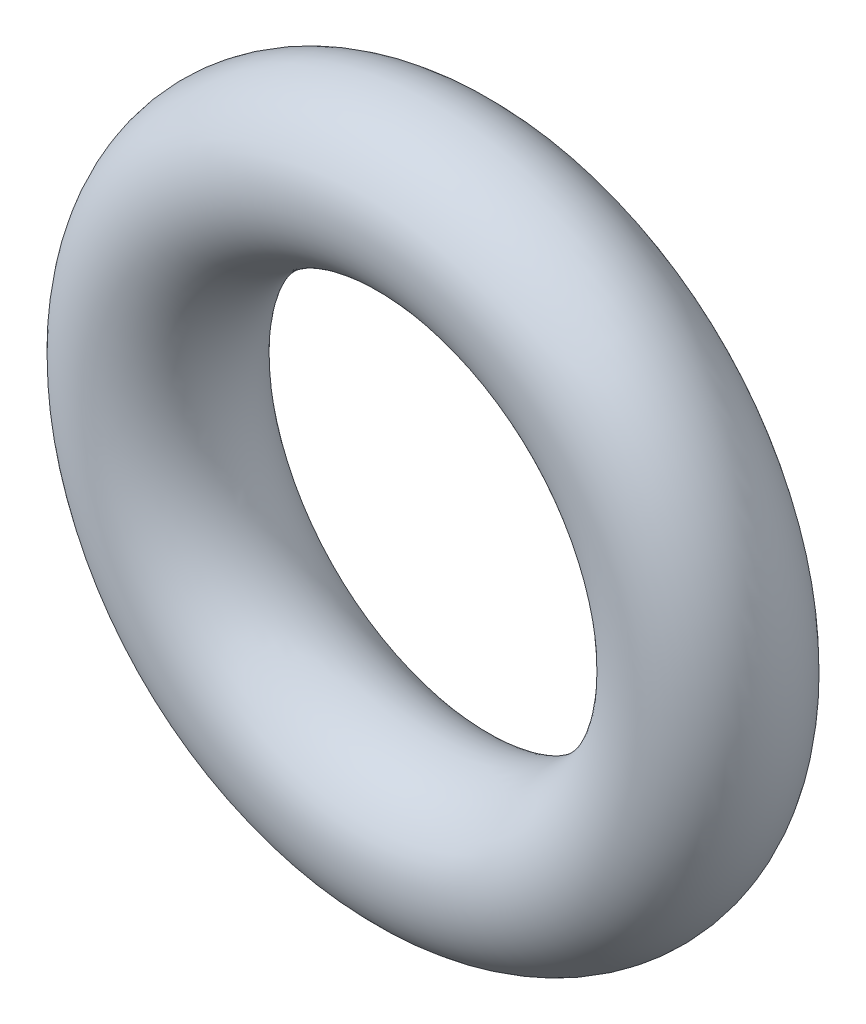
SolidWorks part; units mm, degrees
ref_plane "Front" through (0, 0, 0) normal (0, 0, 1) x (1, 0, 0)
ref_plane "Top" through (0, 0, 0) normal (0, 1, 0) x (1, 0, 0)
ref_plane "Right" through (0, 0, 0) normal (1, 0, 0) x (0, 0, -1)
sketch "Sketch1" plane through (0, 0, 0) normal (1, 0, 0) x (0, -1, 0)
  line L0 (0, -0.5) -> (0, 0.5) construction
  line L2 (-2.475, 0) -> (2.475, 0) construction
  line L3 (-1.25, 0) -> (1.25, 0) construction
  circle A0 centre (1.75, 0) radius 0.5
  point P9 (1.25, 0)
  point P10 (2.25, 0)
  point P13 (1.75, 0.5)
  point P14 (1.75, -0.5)
  dimension "Width" = 1
  dimension "ID" = 2.5
revolve "Revolve1" add sketch "Sketch1" angle 360 about L0
